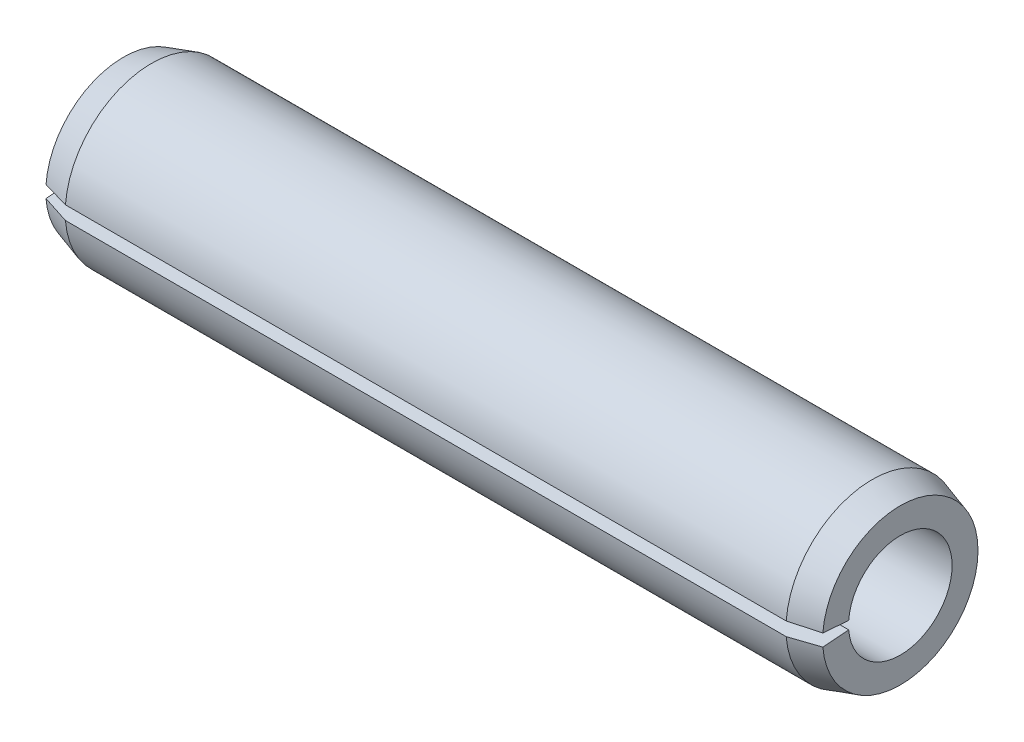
SolidWorks part; units mm, degrees
ref_plane "Plane1" through (0, 0, 0) normal (0, 0, 1) x (1, 0, 0)
ref_plane "Plane2" through (0, 0, 0) normal (0, 1, 0) x (1, 0, 0)
ref_plane "Plane3" through (0, 0, 0) normal (1, 0, 0) x (0, 0, -1)
sketch "Sketch1" plane through (0, 0, 0) normal (0, 0, 1) x (1, 0, 0)
  line L0 (-9.525, 0) -> (111.125, 0) construction
  line L1 (0, 1.2) -> (18, 1.2)
  line L2 (18, 1.2) -> (18, 1.8)
  line L3 (18, 1.8) -> (17.35, 2)
  line L4 (17.35, 2) -> (0.65, 2)
  line L5 (0.65, 2) -> (0, 1.8)
  line L7 (0, 1.8) -> (0, 1.2)
revolve "Base-Revolve" add sketch "Sketch1" angle 360 about L0
sketch "Sketch2" plane through (0, 0, 0) normal (-1, 0, 0) x (0, -1, 0)
  line L0 (0, 0) -> (0.1601, 2.0337)
  line L1 (0, -3.175) -> (0, 12.7) construction
  line L2 (0, 0) -> (-0.1601, 2.0337)
  arc A0 (0.1601, 2.0337) -> (-0.1601, 2.0337) centre (0, 0) ccw
extrude "Gap" cut sketch "Sketch2" against normal through all
equation "\"D1@Sketch2\" = \"Diameter@Sketch1\" * 0.51"
equation "\"D1@Sketch1\" = \"Diameter@Sketch1\" -  ( \"Thickness@Sketch1\" / 2 ) "
equation "\"D2@Sketch1\" = \"D1@Sketch1\""
equation "\"D3@Sketch1\" = \"Chamfer_len@Sketch1\""
